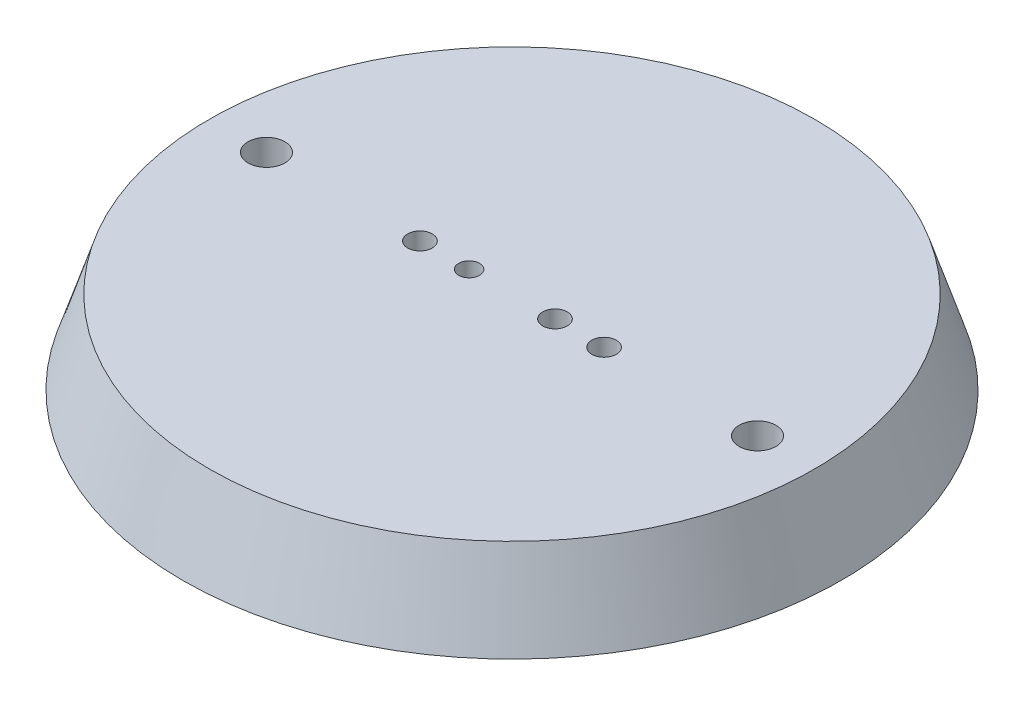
SolidWorks part; units mm, degrees
ref_plane "Front Plane" through (0, 0, 0) normal (0, 0, 1) x (1, 0, 0)
ref_plane "Top Plane" through (0, 0, 0) normal (0, 1, 0) x (1, 0, 0)
ref_plane "Right Plane" through (0, 0, 0) normal (1, 0, 0) x (0, 0, -1)
sketch "Sketch1" plane through (0, 0, 0) normal (1, 0, 0) x (0, 0, -1)
  line L0 (0, 45.4303) -> (0, -38.5469) construction
  line L1 (53.6904, -4.8184) -> (30.4922, -4.8184)
  line L2 (53.6904, -4.8184) -> (49.3309, 8.719)
  line L3 (49.3309, 8.719) -> (0, 8.719)
  line L4 (30.4922, -4.8184) -> (30.4922, 4.8184)
  line L5 (30.4922, 4.8184) -> (0, 4.8184)
  line L6 (0, 8.719) -> (0, 4.8184)
revolve "Revolve1" add sketch "Sketch1" angle 360 about L0
sketch "Sketch6" plane through (0, 8.719, 0) normal (0, 1, 0) x (-1, 0, 0)
  circle A0 centre (15, 0) radius 2
extrude "Cut-Extrude3" cut sketch "Sketch6" against normal through all
sketch "Sketch8" plane through (0, 4.8184, 0) normal (0, -1, 0) x (1, 0, 0)
  circle A0 centre (15, 0) radius 2
extrude "Cut-Extrude4" cut sketch "Sketch8" against normal through all
sketch "Sketch10" plane through (0, -4.8184, 0) normal (0, -1, 0) x (1, 0, 0)
  circle A0 centre (-40, 0) radius 3
extrude "Cut-Extrude5" cut sketch "Sketch10" against normal through all
sketch "Sketch12" plane through (0, -4.8184, 0) normal (0, -1, 0) x (1, 0, 0)
  circle A0 centre (40, 0) radius 3
extrude "Cut-Extrude6" cut sketch "Sketch12" against normal through all
sketch "Sketch2" plane through (0, 8.719, 0) normal (0, 1, 0) x (-1, 0, 0)
  circle A0 centre (15, 0) radius 2
  circle A1 centre (-15, 0) radius 2
sketch "Sketch3" plane through (0, 8.719, 0) normal (0, 1, 0) x (-1, 0, 0)
  circle A0 centre (6.9867, 0) radius 1.6995
extrude "Cut-Extrude1" cut sketch "Sketch3" against normal through all
sketch "Sketch4" plane through (0, 8.719, 0) normal (0, 1, 0) x (-1, 0, 0)
  circle A0 centre (-7, 0) radius 2
extrude "Cut-Extrude2" cut sketch "Sketch4" against normal through all
sketch "Sketch5" plane through (0, 8.719, 0) normal (0, 1, 0) x (-1, 0, 0)
  circle A0 centre (7, 0) radius 2
